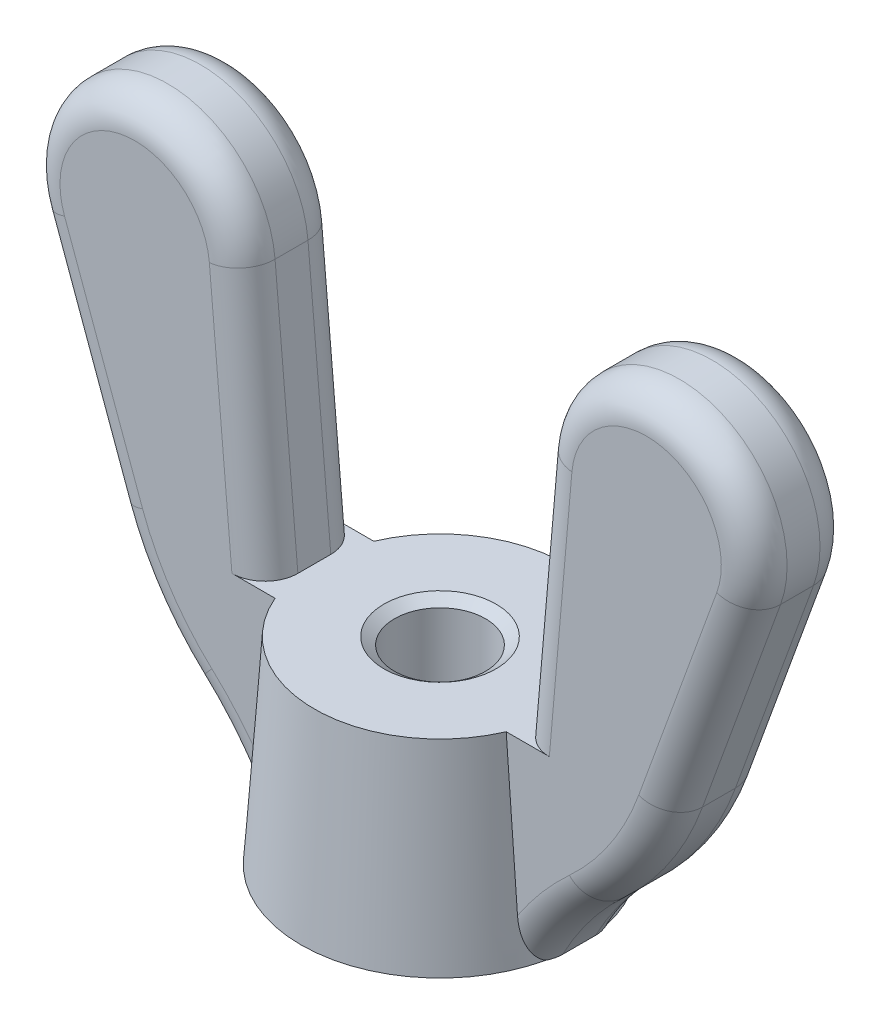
SolidWorks part; units mm, degrees
ref_plane "Front Plane" through (0, 0, 0) normal (0, 0, 1) x (1, 0, 0)
ref_plane "Top Plane" through (0, 0, 0) normal (0, 1, 0) x (1, 0, 0)
ref_plane "Right Plane" through (0, 0, 0) normal (1, 0, 0) x (0, 0, -1)
sketch "WingSke" plane through (0, 0, 0) normal (0, 0, 1) x (1, 0, 0)
  line L0 (-98.8178, 0) -> (98.8178, 0) construction
  line L1 (4.3307, 0) -> (-4.3307, 0) construction
  line L2 (0, 62.7504) -> (0, -62.7504) construction
  line L3 (-3.556, 5.588) -> (3.556, 5.588)
  line L4 (3.556, 5.588) -> (4.2014, 12.9651)
  line L7 (3.937, 0) -> (-3.937, 0)
  line L10 (-4.2014, 12.9651) -> (-3.556, 5.588)
  line L11 (10.1031, 11.6567) -> (7.8943, 5.588)
  line L12 (-10.1031, 11.6567) -> (-7.8943, 5.588)
  arc A0 (4.2014, 12.9651) -> (10.1031, 11.6567) centre (7.2384, 12.6994) cw
  arc A5 (-10.1031, 11.6567) -> (-4.2014, 12.9651) centre (-7.2384, 12.6994) cw
  circle A6 centre (0, 0) radius 3.937 construction
  arc A9 (3.937, 0) -> (5.6879, 2.2788) centre (11.3759, -3.9037) cw
  arc A10 (5.6879, 2.2788) -> (7.8943, 5.588) centre (0, 8.4613) ccw
  arc A11 (-7.8943, 5.588) -> (-5.6879, 2.2788) centre (0, 8.4613) ccw
  arc A12 (-5.6879, 2.2788) -> (-3.937, 0) centre (-11.3759, -3.9037) cw
  point P29 (0, 0)
extrude "Wing" add sketch "WingSke" along normal mid plane 2.794
sketch "BossSke" plane through (0, 0, 0) normal (0, 0, 1) x (1, 0, 0)
  line L0 (-3.556, 5.588) -> (-3.937, 0)
  line L1 (3.556, 5.588) -> (-3.556, 5.588) construction
  line L2 (4.3307, 0) -> (-4.3307, 0) construction
  line L3 (-3.937, 0) -> (0, 0)
  line L4 (0, 0) -> (0, 5.588)
  line L5 (0, 5.588) -> (-3.556, 5.588)
revolve "Boss" add sketch "BossSke" angle 360 about L4
sketch "BossHoleSke" plane through (0, 0, 0) normal (0, 0, 1) x (1, 0, 0)
  line L0 (0, 5.588) -> (0, 0)
  line L1 (3.2701, 5.588) -> (-3.2701, 5.588) construction
  line L2 (0, 0) -> (1.2891, 0)
  line L3 (4.3307, 0) -> (-4.3307, 0) construction
  line L5 (1.2891, 0) -> (1.2891, 5.588)
  line L7 (1.2891, 5.588) -> (0, 5.588)
  line L8 (0, 5.588) -> (0, 11.176) construction
revolve "BossHole" cut sketch "BossHoleSke" angle 360 about L8
sketch "Sketch7" plane through (0, 0, 0) normal (0, 0, 1) x (1, 0, 0)
  line L0 (1.289, 5.379) -> (1.5875, 5.588)
  line L1 (1.2891, 0) -> (1.2891, 5.588) construction
  line L2 (3.2701, 5.588) -> (-3.2701, 5.588) construction
  line L5 (1.2891, 5.588) -> (1.289, 5.379)
  line L6 (1.2891, 0.209) -> (1.2891, 0)
  line L7 (1.2891, 0) -> (1.5875, 0)
  line L8 (-3.6808, 0) -> (3.6808, 0) construction
  line L9 (1.5875, 0) -> (1.2891, 0.209)
  line L10 (1.2891, 5.588) -> (1.5875, 5.588)
revolve "Cut-Revolve2" cut sketch "Sketch7" angle 360 about L2
fillet "WingFillet" radius 0.9313 20 edges at (7.8982, 15.6757, -1.397) (-7.8982, 15.6757, -1.397) (7.8982, 15.6757, 1.397) (-7.8982, 15.6757, 1.397) (3.8787, 9.2766, -1.397) (-3.8787, 9.2766, -1.397) (3.8787, 9.2766, 1.397) (-3.8787, 9.2766, 1.397) (4.7143, 1.2148, -1.397) (6.9898, 3.8009, -1.397) (8.9987, 8.6224, -1.397) (-4.7143, 1.2148, -1.397) (-6.9898, 3.8009, -1.397) (-8.9987, 8.6224, -1.397) (4.7143, 1.2148, 1.397) (6.9898, 3.8009, 1.397) (8.9987, 8.6224, 1.397) (-4.7143, 1.2148, 1.397) (-6.9898, 3.8009, 1.397) (-8.9987, 8.6224, 1.397)
sketch "ThdSchSke" plane through (0, 0, 0) normal (0, 0, 1) x (1, 0, 0)
  line L0 (0, 0) -> (0, 5.588) construction
  line L1 (3.2701, 5.588) -> (-3.2701, 5.588) construction
  line L2 (-0.6445, 5.7716) -> (-0.6445, 5.3536)
  line L3 (-0.6445, 5.3536) -> (-1.2891, 5.3536)
  line L4 (-1.2891, 5.3536) -> (-1.5875, 5.5626)
  line L5 (-1.5875, 5.5626) -> (-1.2891, 5.7716)
  line L6 (-1.2891, 5.7716) -> (-0.6445, 5.7716)
  line L7 (0, 5.0343) -> (1.8519, 5.0343) construction
revolve "ThreadSchematic" [suppressed] cut sketch "ThdSchSke" angle 360 about L0
pattern_linear "ThdSchPat" [suppressed]
equation "\"D1@WingFillet\"=\"WingThicknessC@Wing\"/3"
equation "\"Tap_drill@ThdSchSke\" = \"Thread_min@BossHoleSke\""
equation "\"Thread_major@ThdSchSke\" = \"Thread_Major@ThreadCosmetic\""
equation "\"D1@ThdSchSke\" = \"Tap_drill@ThdSchSke\" * 0.5"
equation "\"Num_Threads@ThdSchPat\"=int(  (\"BossHeightG@WingSke\" - 0.002 ) / \"Advance@ThdSchSke\" + 0.999 )  + 1"
equation "\"D3@Sketch7\" = \"Thread_Major@ThreadCosmetic\" * 0.5"
